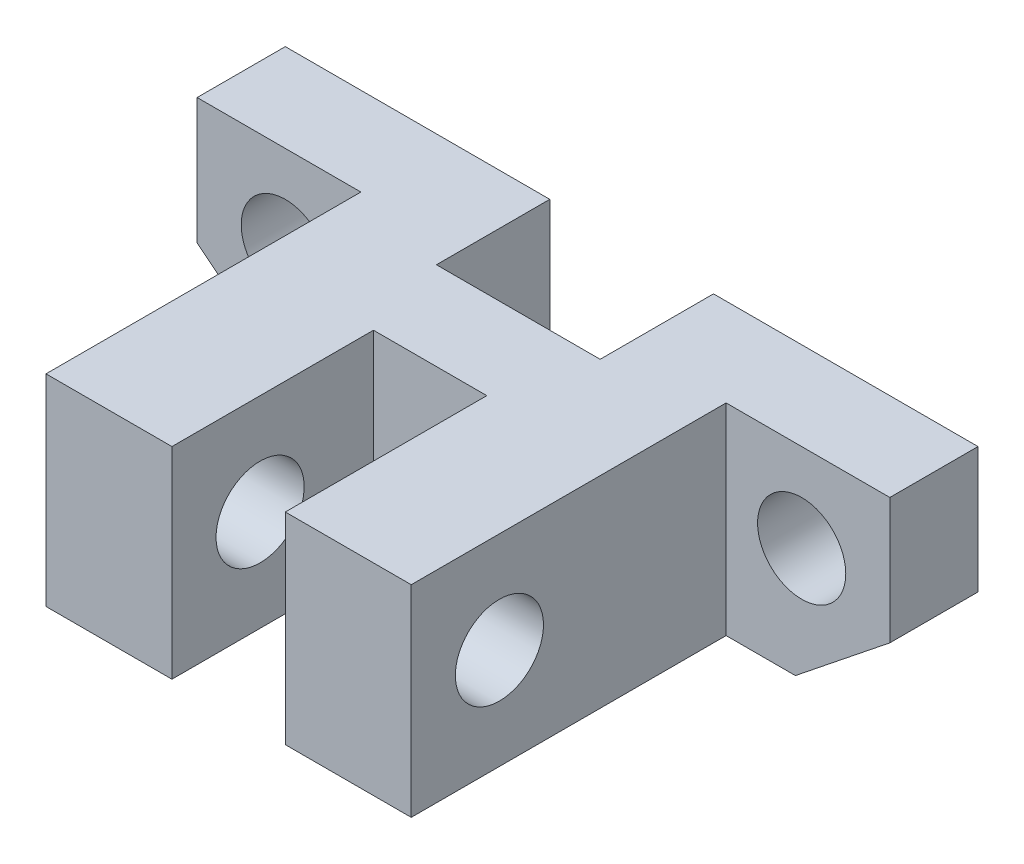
SolidWorks part; units mm, degrees
ref_plane "Alzado" through (0, 0, 0) normal (0, 0, 1) x (1, 0, 0)
ref_plane "Planta" through (0, 0, 0) normal (0, 1, 0) x (1, 0, 0)
ref_plane "Vista lateral" through (0, 0, 0) normal (1, 0, 0) x (0, 0, -1)
sketch "Croquis1" plane through (0, 0, 0) normal (0, 0, 1) x (1, 0, 0)
  line L0 (-20, -11) -> (-27.5, -5)
  line L1 (-27.5, 5) -> (27.5, 5)
  line L2 (-27.5, 5) -> (-27.5, -5)
  line L4 (27.5, 5) -> (27.5, -5)
  line L7 (-20, -11) -> (20, -11)
  line L13 (20, -11) -> (27.5, -5)
  point P0 (0, 0)
  point P5 (0, -8)
  dimension "D1" = 55
  dimension "D2" = 10
  dimension "D4" = 40
  dimension "D5" = 16
extrude "Saliente-Extruir1" add sketch "Croquis1" along normal blind 32
sketch "Croquis3" plane through (27.5, 0, 0) normal (1, 0, 0) x (0, 0, -1)
  line L0 (0, -5) -> (0, 5) construction
  line L1 (-35.1492, 16.7278) -> (-7, 16.7278)
  line L2 (-35.1492, 16.7278) -> (-35.1492, -16.7278)
  line L3 (-35.1492, -16.7278) -> (-7, -16.7278)
  line L4 (-7, 16.7278) -> (-7, -16.7278)
  line L5 (-35.1492, 16.7278) -> (-7, -16.7278) construction
  line L6 (-35.1492, -16.7278) -> (-7, 16.7278) construction
  point P0 (-21.0746, 0)
  dimension "D1" = 7
extrude "Cortar-Extruir1" cut sketch "Croquis3" against normal blind 13
sketch "Croquis4" plane through (-27.5, 0, 0) normal (-1, 0, 0) x (0, 0, 1)
  line L0 (0, 5) -> (0, -5) construction
  line L1 (7, 10.792) -> (39.2728, 10.792)
  line L2 (7, 10.792) -> (7, -18.4858)
  line L3 (7, -18.4858) -> (39.2728, -18.4858)
  line L4 (39.2728, 10.792) -> (39.2728, -18.4858)
  line L5 (7, 10.792) -> (39.2728, -18.4858) construction
  line L6 (7, -18.4858) -> (39.2728, 10.792) construction
  point P0 (23.1364, -3.8469)
  dimension "D1" = 7
extrude "Cortar-Extruir2" cut sketch "Croquis4" against normal blind 13
sketch "Croquis5" plane through (0, -11, 0) normal (0, -1, 0) x (1, 0, 0)
  line L0 (-20, 0) -> (20, 0) construction
  line L1 (-6.5, 9) -> (6.5, 9)
  line L2 (-6.5, 9) -> (-6.5, 0)
  line L3 (-6.5, 0) -> (6.5, 0)
  line L4 (6.5, 9) -> (6.5, 0)
  line L5 (-6.5, 9) -> (6.5, 0) construction
  line L6 (-6.5, 0) -> (6.5, 9) construction
  point P0 (0, 4.5)
  dimension "D1" = 13
  dimension "D2" = 6.5
  dimension "D3" = 9
extrude "Cortar-Extruir3" cut sketch "Croquis5" against normal through all
sketch "Croquis6" plane through (0, -11, 0) normal (0, -1, 0) x (1, 0, 0)
  line L0 (6.5, 9) -> (-6.5, 9) construction
  line L1 (-4.5, 16) -> (4.5, 16)
  line L2 (-4.5, 16) -> (-4.5, 39)
  line L3 (-4.5, 39) -> (4.5, 39)
  line L4 (4.5, 16) -> (4.5, 39)
  line L5 (-4.5, 16) -> (4.5, 39) construction
  line L6 (-4.5, 39) -> (4.5, 16) construction
  point P0 (0, 27.5)
  dimension "D1" = 9
  dimension "D2" = 4.5
  dimension "D4" = 7
extrude "Cortar-Extruir4" cut sketch "Croquis6" against normal through all
sketch "Croquis7" plane through (14.5, 0, 0) normal (1, 0, 0) x (0, 0, -1)
  line L0 (-7, -3) -> (-25, -3) construction
  line L1 (-7, -11) -> (-7, 5) construction
  line L2 (-7, 5) -> (-7, -11) construction
  circle A0 centre (-25, -3) radius 3.5
  point P10 (-7, -0.6065)
  point P11 (-7, -3)
  point P12 (0, 0)
  point P15 (-25.7991, -2.1297)
  point P16 (-26.9229, -2.2645)
  dimension "D1" = 7
  dimension "D2" = 18
extrude "Cortar-Extruir5" cut sketch "Croquis7" against normal through all
sketch "Croquis9" plane through (0, 0, 7) normal (0, 0, 1) x (1, 0, 0)
  line L0 (-27.5, 5) -> (-14.5, 5) construction
  line L1 (14.5, 5) -> (27.5, 5) construction
  line L3 (-27.5, 5) -> (-27.5, -5) construction
  line L4 (27.5, -5) -> (27.5, 5) construction
  circle A0 centre (20.5, -2) radius 3.5
  circle A1 centre (-20.5, -2) radius 3.5
  dimension "D1" = 7
  dimension "D2" = 7
  dimension "D3" = 7
  dimension "D4" = 7
  dimension "D5" = 7
  dimension "D6" = 7
extrude "Cortar-Extruir6" cut sketch "Croquis9" against normal through all
